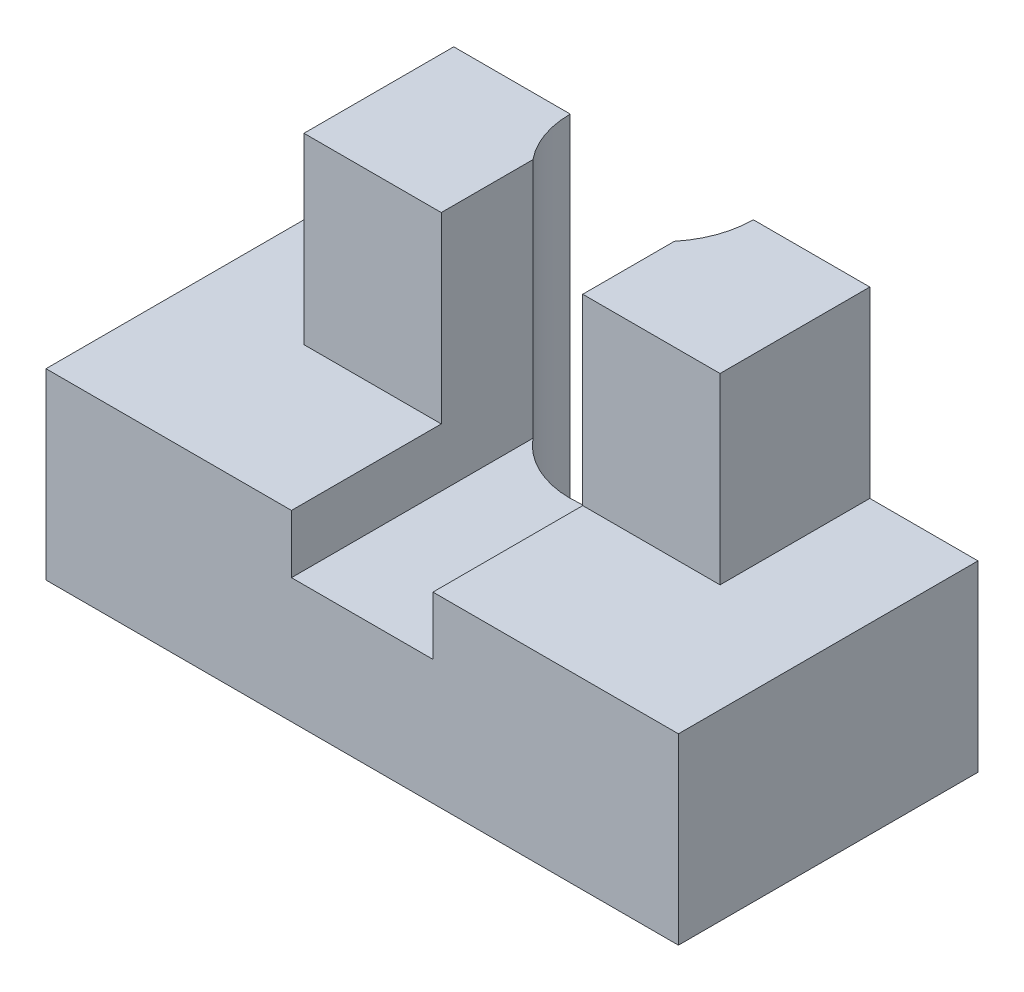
SolidWorks part; units mm, degrees
ref_plane "前视基准面" through (0, 0, 0) normal (0, 0, 1) x (1, 0, 0)
ref_plane "上视基准面" through (0, 0, 0) normal (0, 1, 0) x (1, 0, 0)
ref_plane "右视基准面" through (0, 0, 0) normal (1, 0, 0) x (0, 0, -1)
sketch "草图1" plane through (0, 0, 0) normal (0, 1, 0) x (1, 0, 0)
  line L0 (0, 0) -> (0, -75.8716) construction
  line L1 (0, -75.8716) -> (0, 0) construction
  line L2 (0, 0) -> (95.542, 0) construction
  line L4 (-38, 18) -> (38, 18)
  line L5 (-38, 18) -> (-38, -18)
  line L6 (-38, -18) -> (38, -18)
  line L7 (38, 18) -> (38, -18)
extrude "拉伸1" add sketch "草图1" along normal blind 22
sketch "草图2" plane through (0, 22, 0) normal (0, 1, 0) x (1, 0, 0)
  line L0 (38, 18) -> (-38, 18) construction
  line L1 (0, 18) -> (25, 18)
  line L3 (0, 0) -> (25, 0)
  line L4 (25, 18) -> (25, 0)
  line L6 (0, 18) -> (-25, 18)
  line L8 (0, 0) -> (-25, 0)
  line L9 (-25, 18) -> (-25, 0)
extrude "拉伸2" add sketch "草图2" along normal blind 22
sketch "草图4" plane through (0, 0, 18) normal (0, 0, 1) x (1, 0, 0)
  line L0 (0, 0) -> (0, 52.8174) construction
  line L1 (-38, 0) -> (38, 0) construction
  line L2 (-8.5, 48.7293) -> (8.5, 48.7293)
  line L3 (-8.5, 48.7293) -> (-8.5, 15)
  line L4 (-8.5, 15) -> (8.5, 15)
  line L5 (8.5, 48.7293) -> (8.5, 15)
  dimension "D1" = 15
  dimension "D2" = 17
extrude "切除-拉伸1" cut sketch "草图4" against normal through all
sketch "草图5" plane through (0, 0, -18) normal (0, 0, -1) x (-1, 0, 0)
  line L0 (0, 0) -> (0, 54.7587) construction
  line L1 (0, 0) -> (11, 0)
  line L2 (0, 0) -> (0, 50.2695)
  line L3 (0, 50.2695) -> (11, 50.2695)
  line L4 (11, 0) -> (11, 50.2695)
revolve "切除-旋转1" cut sketch "草图5" angle 360 about L0
